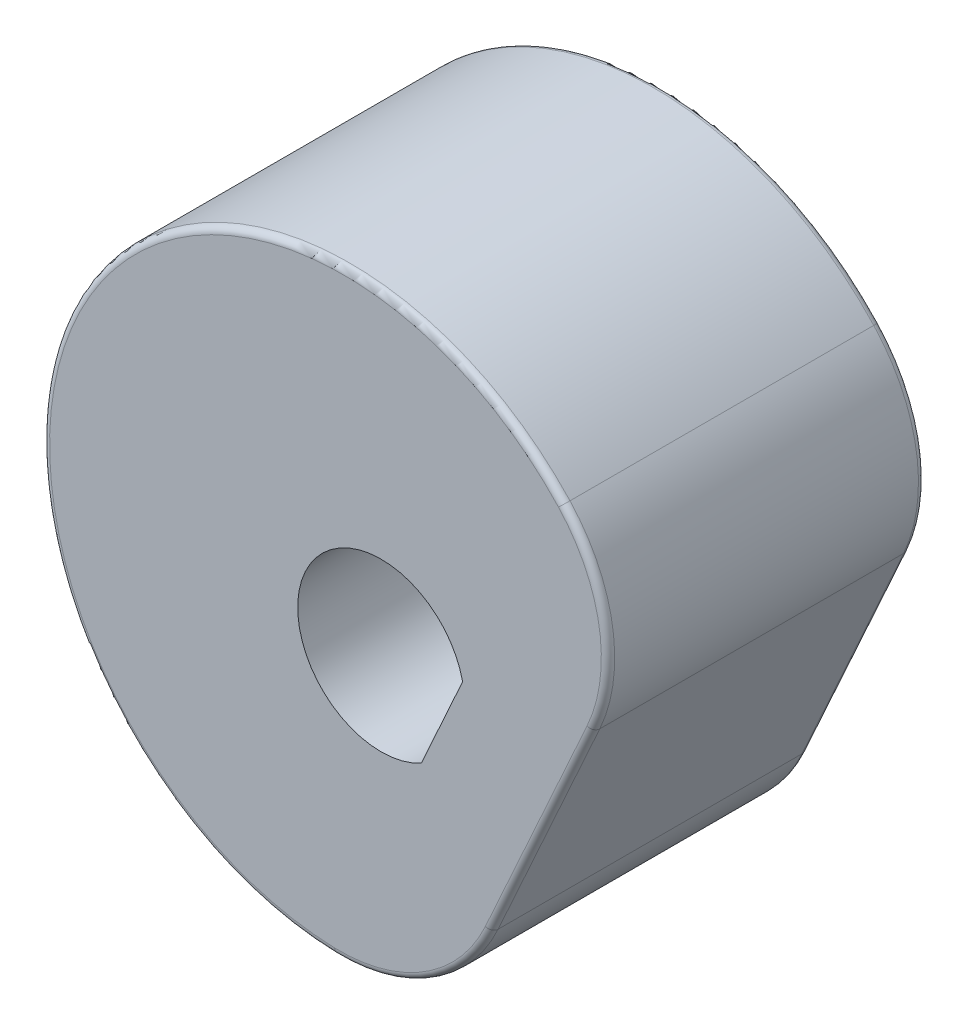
SolidWorks part; units mm, degrees
ref_plane "Front Plane" through (0, 0, 0) normal (0, 0, 1) x (1, 0, 0)
ref_plane "Top Plane" through (0, 0, 0) normal (0, 1, 0) x (1, 0, 0)
ref_plane "Right Plane" through (0, 0, 0) normal (1, 0, 0) x (0, 0, -1)
ref_plane "Plane1" through (0, 0, 57.7) normal (0, 0, 1) x (1, 0, 0)
sketch "Sketch1" plane through (0, 0, 57.7) normal (0, 0, 1) x (1, 0, 0)
  line L0 (-7.9547, 105.158) -> (-9.1929, 102.4254)
  line L1 (-7.0911, 99.0684) -> (-4.0449, 105.7909)
  arc A0 (-9.1929, 102.4254) -> (-7.9547, 105.158) centre (-10.3955, 104.6172) cw
  arc A1 (-4.938, 111.2599) -> (-11.792, 96.1342) centre (-11.528, 105.1303) ccw
  arc A2 (-11.792, 96.1342) -> (-7.0911, 99.0684) centre (-11.6454, 101.1321) ccw
  arc A3 (-4.0449, 105.7909) -> (-4.938, 111.2599) centre (-8.5991, 107.8546) ccw
extrude "Boss-Extrude1" add sketch "Sketch1" against normal blind 9.5
fillet "Fillet1" radius 0.2 8 edges at (-8.9979, 96.8905, 48.2) (-8.9979, 96.8905, 57.7) (-5.568, 102.4296, 57.7) (-5.568, 102.4296, 48.2) (-3.6645, 108.6605, 57.7) (-3.6645, 108.6605, 48.2) (-19.7257, 108.845, 48.2) (-19.7257, 108.845, 57.7)
